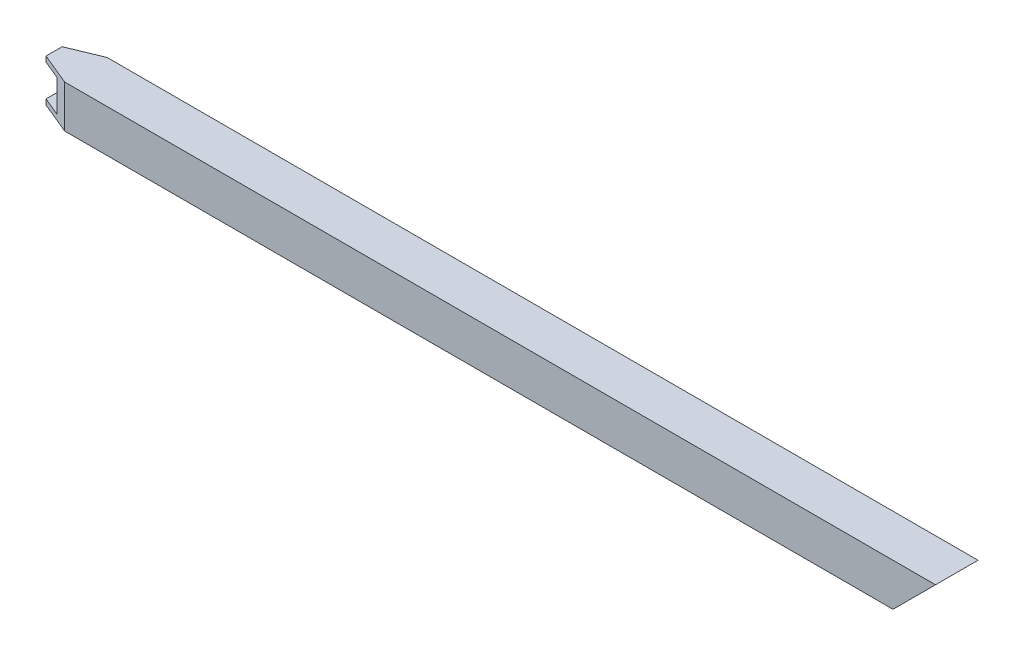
SolidWorks part; units mm, degrees
ref_plane "Front Plane" through (0, 0, 0) normal (0, 0, 1) x (1, 0, 0)
ref_plane "Top Plane" through (0, 0, 0) normal (0, 1, 0) x (1, 0, 0)
ref_plane "Right Plane" through (0, 0, 0) normal (1, 0, 0) x (0, 0, -1)
sketch "Sketch1" plane through (0, 0, 0) normal (1, 0, 0) x (0, 0, -1)
  line L1 (-12.7, -12.7) -> (12.7, -12.7)
  line L2 (-12.7, -12.7) -> (-12.7, 12.7)
  line L3 (-12.7, 12.7) -> (12.7, 12.7)
  line L4 (12.7, -12.7) -> (12.7, 12.7)
  line L5 (-12.7, -12.7) -> (12.7, 12.7) construction
  line L6 (-12.7, 12.7) -> (12.7, -12.7) construction
  line L7 (-9.525, -9.525) -> (9.525, -9.525)
  line L8 (-9.525, -9.525) -> (-9.525, 9.525)
  line L9 (-9.525, 9.525) -> (9.525, 9.525)
  line L10 (9.525, -9.525) -> (9.525, 9.525)
  line L11 (-9.525, -9.525) -> (9.525, 9.525) construction
  line L12 (-9.525, 9.525) -> (9.525, -9.525) construction
  point P0 (0, 0)
  point P6 (0, 0)
  dimension "D1" = 25.4
  dimension "D2" = 3.175
  dimension "D3" = 3.175
extrude "Boss-Extrude1" add sketch "Sketch1" along normal blind 539.75
sketch "Sketch2" plane through (0, 0, -12.7) normal (0, 0, -1) x (-1, 0, 0)
  line L0 (-539.75, 12.7) -> (-514.35, -12.7)
  line L1 (-539.75, -12.7) -> (0, -12.7) construction
  line L2 (-514.35, -12.7) -> (0, -12.7)
  line L3 (0, -12.7) -> (0, 12.7)
  line L4 (0, 12.7) -> (-539.75, 12.7)
  dimension "D1" = 45
extrude "Cut-Extrude1" cut sketch "Sketch2" against normal through all flip side to cut
sketch "Sketch3" plane through (0, 12.7, 0) normal (0, 1, 0) x (1, 0, 0)
  line L0 (539.75, -12.7) -> (539.75, 12.7)
  line L1 (539.75, 12.7) -> (19.05, 12.7)
  line L2 (539.75, 12.7) -> (0, 12.7) construction
  line L3 (19.05, -12.7) -> (0, -4.8092)
  line L5 (0, 12.7) -> (0, -12.7) construction
  line L6 (539.75, -12.7) -> (0, -12.7) construction
  line L8 (19.05, -12.7) -> (539.75, -12.7)
  line L9 (0, -4.8092) -> (0, 4.8092)
  line L10 (0, 4.8092) -> (19.05, 12.7)
  point P8 (0, 0)
  dimension "D1" = 22.5
  dimension "D2" = 19.05
extrude "Cut-Extrude2" cut sketch "Sketch3" against normal through all flip side to cut
